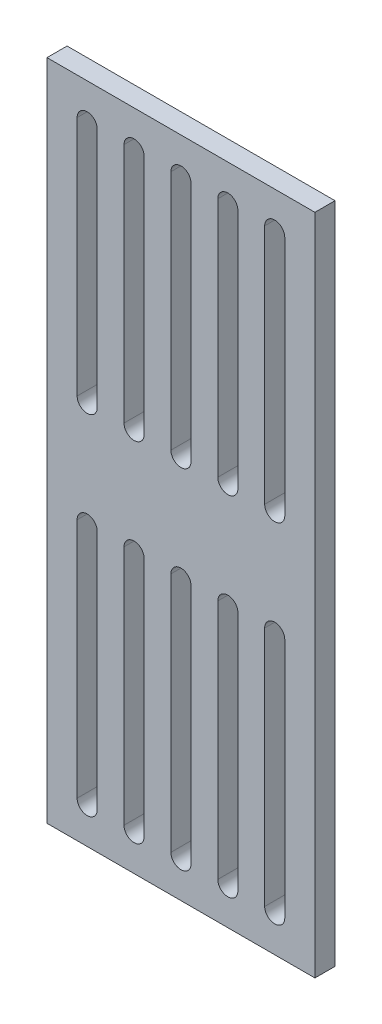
SolidWorks part; units mm, degrees
ref_plane "Front Plane" through (0, 0, 0) normal (0, 0, 1) x (1, 0, 0)
ref_plane "Top Plane" through (0, 0, 0) normal (0, 1, 0) x (1, 0, 0)
ref_plane "Right Plane" through (0, 0, 0) normal (1, 0, 0) x (0, 0, -1)
sketch "Sketch1" plane through (0, 0, 0) normal (0, 0, 1) x (1, 0, 0)
  line L1 (-127, 314.325) -> (127, 314.325)
  line L2 (-127, 314.325) -> (-127, -314.325)
  line L3 (-127, -314.325) -> (127, -314.325)
  line L4 (127, 314.325) -> (127, -314.325)
  line L5 (-127, 314.325) -> (127, -314.325) construction
  line L6 (-127, -314.325) -> (127, 314.325) construction
  point P0 (0, 0)
  dimension "D1" = 628.65
  dimension "D2" = 254
extrude "Boss-Extrude1" add sketch "Sketch1" along normal blind 19.05
sketch "Sketch2" plane through (0, 0, 19.05) normal (0, 0, 1) x (1, 0, 0)
  line L0 (0, 279.4) -> (0, 50.8) construction
  line L1 (9.525, 279.4) -> (9.525, 50.8)
  line L2 (-9.525, 279.4) -> (-9.525, 50.8)
  arc A0 (9.525, 279.4) -> (-9.525, 279.4) centre (0, 279.4) ccw
  arc A1 (-9.525, 50.8) -> (9.525, 50.8) centre (0, 50.8) ccw
  point P2 (0, 165.1)
  dimension "D1" = 19.05
  dimension "D2" = 228.6
  dimension "D3" = 50.8
extrude "Cut-Extrude1" cut sketch "Sketch2" against normal through all both and the other way through all
pattern_linear "LPattern1" count 3 spacing 44.45 along (1, 0, 0) count 3 spacing 44.45 along (-1, 0, 0) of "Cut-Extrude1"
mirror "Mirror1" about plane through (0, 0, 0) normal (0, 1, 0) of "LPattern1", "Cut-Extrude1"
